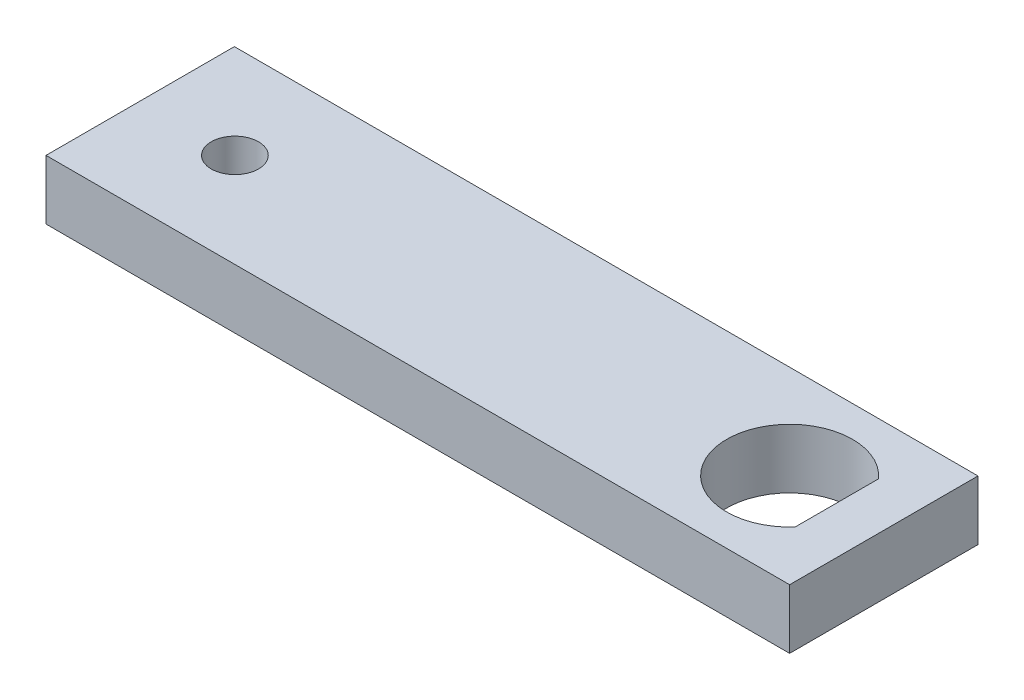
SolidWorks part; units mm, degrees
ref_plane "Front" through (0, 0, 0) normal (0, 0, 1) x (1, 0, 0)
ref_plane "Top" through (0, 0, 0) normal (0, 1, 0) x (-1, 0, 0)
ref_plane "Right" through (0, 0, 0) normal (1, 0, 0) x (0, 0, -1)
sketch "Sketch1" plane through (0, 0, 0) normal (0, 0, 1) x (1, 0, 0)
  line L0 (0, 0) -> (75, 0)
  line L1 (0, 0) -> (0, 6)
  line L2 (75, 6) -> (0, 6)
  line L3 (75, 6) -> (75, 0)
  dimension "D1" = 6
  dimension "D2" = 75
extrude "Base-Extrude" add sketch "Sketch1" along normal blind 19
sketch "Sketch2" plane through (0, 6, 0) normal (0, 1, 0) x (-1, 0, 0)
  line L0 (-75, 19) -> (-75, 0) construction
  line L1 (-75, 19) -> (0, 19) construction
  line L2 (-70.2375, 5.2749) -> (-70.2375, 13.6751)
  arc A0 (-70.2375, 5.2749) -> (-70.2375, 13.6751) centre (-65.475, 9.475) ccw
  dimension "D1" = 12.7
  dimension "D2" = 9.525
  dimension "D3" = 9.525
  dimension "D4" = 1.5875
extrude "Cut-Extrude1" cut sketch "Sketch2" against normal through all
sketch "Sketch3" plane through (0, 6, 0) normal (0, 1, 0) x (-1, 0, 0)
  line L0 (0, 19) -> (0, 0) construction
  circle A0 centre (-9.525, 9.475) radius 2.3813
  arc A1 (-70.2375, 5.2749) -> (-70.2375, 13.6751) centre (-65.475, 9.475) ccw construction
  point P5 (-65.475, 9.475)
  dimension "D1" = 4.7625
  dimension "D2" = 9.525
extrude "Cut-Extrude2" cut sketch "Sketch3" against normal through all
